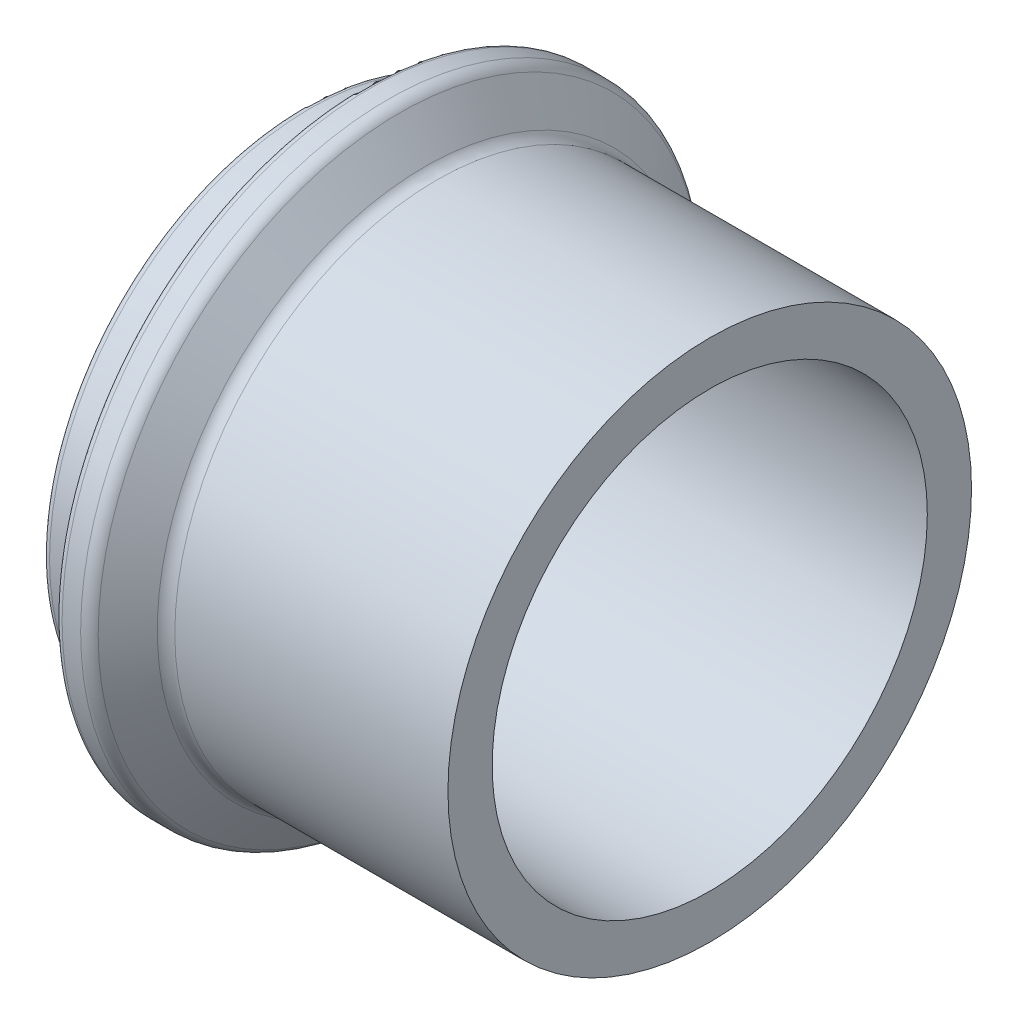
SolidWorks part; units mm, degrees
ref_plane "Front Plane" through (0, 0, 0) normal (0, 0, 1) x (1, 0, 0)
ref_plane "Top Plane" through (0, 0, 0) normal (0, 1, 0) x (1, 0, 0)
ref_plane "Right Plane" through (0, 0, 0) normal (1, 0, 0) x (0, 0, -1)
sketch "Sketch1" plane through (0, 0, 0) normal (0, 0, 1) x (1, 0, 0)
  line L0 (0, 0) -> (-37.0343, 0) construction
  line L1 (0, 23.749) -> (-44.45, 23.749)
  line L2 (-44.45, 23.749) -> (-44.45, 27.6098)
  line L3 (-43.6372, 28.4226) -> (-38.7858, 28.4226)
  line L4 (-37.973, 29.2354) -> (-37.973, 32.7152)
  line L5 (-37.1602, 33.528) -> (-35.1386, 33.528)
  line L6 (-33.8607, 32.8908) -> (-31.0886, 29.2122)
  line L7 (-29.8106, 28.575) -> (0, 28.575)
  line L8 (0, 28.575) -> (0, 23.749)
  arc A0 (-37.1602, 33.528) -> (-37.973, 32.7152) centre (-37.1602, 32.7152) ccw
  arc A1 (-37.973, 29.2354) -> (-38.7858, 28.4226) centre (-38.7858, 29.2354) cw
  arc A2 (-43.6372, 28.4226) -> (-44.45, 27.6098) centre (-43.6372, 27.6098) ccw
  arc A3 (-29.8106, 28.575) -> (-31.0886, 29.2122) centre (-29.8106, 30.1752) cw
  arc A4 (-33.8607, 32.8908) -> (-35.1386, 33.528) centre (-35.1386, 31.9278) ccw
  point P13 (-37.973, 33.528)
  point P18 (-44.45, 28.4226)
  point P23 (-34.3408, 33.528)
  dimension "D7" = 0.8128
  dimension "D8" = 1.6002
  dimension "D1" = 23.749
  dimension "D2" = 28.575
  dimension "D3" = 33.528
  dimension "D4" = 28.4226
  dimension "D5" = 3.6322
  dimension "D6" = 6.477
  dimension "D9" = 44.45
revolve "Revolve1" add sketch "Sketch1" angle 360 about L0
